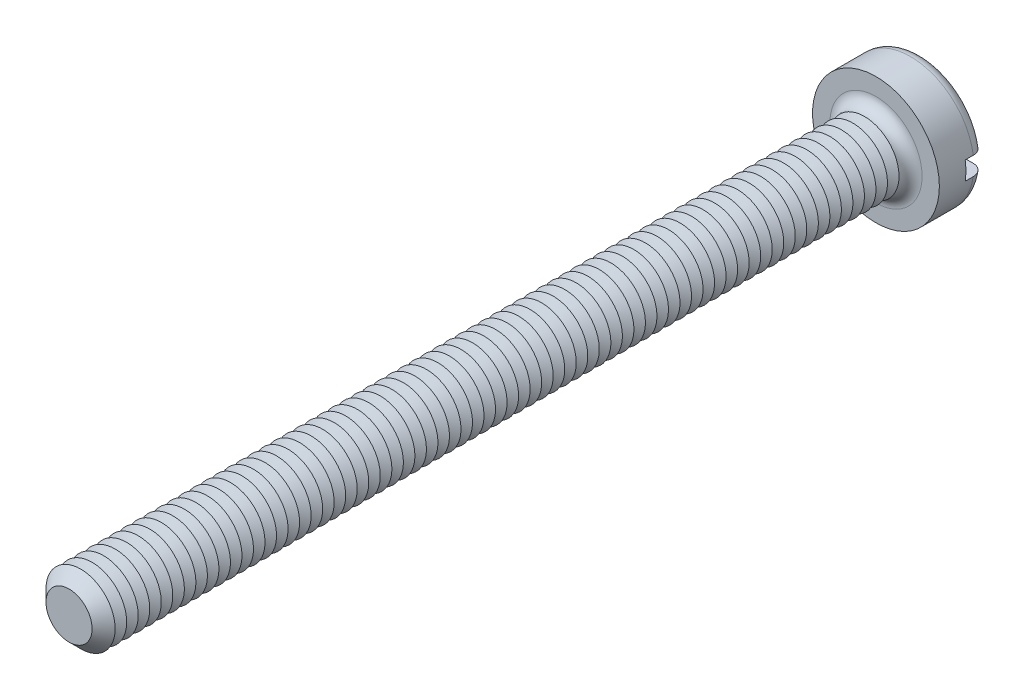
SolidWorks part; units mm, degrees
ref_plane "Front Plane" through (0, 0, 0) normal (0, 0, 1) x (1, 0, 0)
ref_plane "Top Plane" through (0, 0, 0) normal (0, 1, 0) x (1, 0, 0)
ref_plane "Right Plane" through (0, 0, 0) normal (1, 0, 0) x (0, 0, -1)
sketch "Sketch3" plane through (0, 0, 0) normal (0, 0, 1) x (1, 0, 0)
  circle A0 centre (0, 0) radius 2.75
  dimension "D1" = 5.5
extrude "Boss-Extrude2" add sketch "Sketch3" against normal blind 2
sketch "Sketch4" plane through (0, 0, 0) normal (0, 0, 1) x (1, 0, 0)
  circle A0 centre (0, 0) radius 1.5
  dimension "D1" = 3
extrude "Boss-Extrude3" add sketch "Sketch4" along normal blind 35
fillet "Fillet1" radius 0.5 2 edges at (2.75, 0, -2) (1.5, 0, 0)
chamfer "Chamfer1" distance 0.5 angle 45 1 edges at (1.5, 0, 35)
sketch "Sketch5" plane through (0, 0, 0) normal (1, 0, 0) x (0, 0, -1)
  line L0 (1.6944, 0) -> (-7.6738, 0) construction
sketch "Sketch6" plane through (0, 0, 0) normal (1, 0, 0) x (0, 0, -1)
  line L0 (-0.5, 1.5) -> (-0.75, 1.067)
  line L1 (-0.75, 1.067) -> (-1, 1.5)
  line L2 (-0.5, 1.5) -> (-34.5, 1.5) construction
  line L3 (-1, 1.5) -> (-0.5, 1.5)
  dimension "D1" = 0.5
revolve "Cut-Revolve1" cut sketch "Sketch6" angle 360 about L0
pattern_linear "LPattern1" count 68 spacing 0.5 along (0, 0, 1) of "Cut-Revolve1"
sketch "Sketch8" plane through (0, 0, -2) normal (0, 0, -1) x (-1, 0, 0)
  line L1 (2.75, -0.4) -> (-2.75, -0.4)
  line L2 (2.75, -0.4) -> (2.75, 0.4)
  line L3 (2.75, 0.4) -> (-2.75, 0.4)
  line L4 (-2.75, -0.4) -> (-2.75, 0.4)
  line L5 (2.75, -0.4) -> (-2.75, 0.4) construction
  line L6 (2.75, 0.4) -> (-2.75, -0.4) construction
  point P0 (0, 0)
  dimension "D1" = 5.5
  dimension "D2" = 0.8
extrude "Cut-Extrude1" cut sketch "Sketch8" against normal blind 0.85
